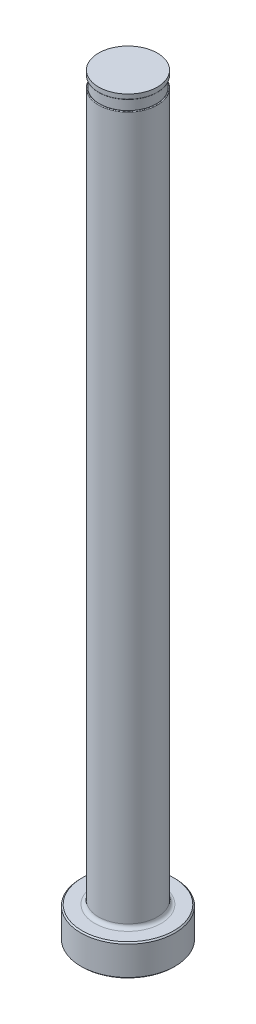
SolidWorks part; units mm, degrees
ref_plane "Front Plane" through (0, 0, 0) normal (0, 0, 1) x (1, 0, 0)
ref_plane "Top Plane" through (0, 0, 0) normal (0, 1, 0) x (1, 0, 0)
ref_plane "Right Plane" through (0, 0, 0) normal (1, 0, 0) x (0, 0, -1)
other "Configuration Table"
sketch "Sketch1" plane through (0, 0, 0) normal (0, 0, 1) x (1, 0, 0)
  line L0 (0, 259.9588) -> (0, -15.1925) construction
  line L1 (0, 0) -> (-9.525, 0)
  line L2 (-9.525, 0) -> (-9.525, 6.35)
  line L3 (-9.525, 6.35) -> (-5.9525, 6.35)
  line L4 (-5.9525, 6.35) -> (-5.9525, 152.4)
  line L5 (-5.9525, 152.4) -> (0, 152.4)
  line L6 (0, 152.4) -> (0, 0)
  dimension "L" = 152.4
  dimension "H" = 19.05
  dimension "T" = 6.35
  dimension "D" = 11.905
revolve "Revolve1" add sketch "Sketch1" angle 360 about L0
chamfer "Chamfer1" distance 0.254 angle 45 2 edges at (0, 6.35, 9.525) (0, 0, 9.525)
fillet "Fillet1" radius 0.762 1 edges at (0, 6.35, 5.9525)
sketch "Sketch2" plane through (0, 0, 0) normal (0, 0, 1) x (1, 0, 0)
  line L0 (-5.9525, 152.4) -> (-5.9525, 7.112) construction
  line L1 (-5.9525, 151.384) -> (-5.7493, 151.384)
  line L2 (-5.9525, 151.384) -> (-5.9525, 149.352)
  line L3 (-5.9525, 149.352) -> (-5.7493, 149.352)
  line L4 (-5.7493, 151.384) -> (-5.7493, 149.352)
  line L5 (5.9525, 152.4) -> (-5.9525, 152.4) construction
  line L6 (0, 153.4483) -> (0, 147.3282) construction
  dimension "D1" = 2.032
  dimension "N" = 1.016
  dimension "FD" = 0.2032
  dimension "D3" = 11.4986
revolve "Vent Relief" cut sketch "Sketch2" angle 360 about L6
sketch "Sketch3" plane through (0, 0, 0) normal (0, 0, 1) x (1, 0, 0)
  line L0 (-5.7493, 150.368) -> (-5.7493, 86.868)
  line L1 (-5.7493, 151.384) -> (-5.7493, 149.352) construction
  line L2 (-5.9525, 149.352) -> (-5.9525, 7.112) construction
  line L3 (-5.9525, 85.7504) -> (-5.9525, 150.368)
  line L4 (-5.9525, 150.368) -> (-5.7493, 150.368)
  arc A0 (-5.7493, 86.868) -> (-5.9525, 85.7504) centre (-8.9243, 86.868) cw
  dimension "D1" = 3.175
  dimension "D2" = 63.5
extrude "D-Slot" cut sketch "Sketch3" against normal through all both and the other way through all
sketch "Sketch5" plane through (0, 0, 0) normal (0, 0, 1) x (1, 0, 0)
  line L0 (-5.9525, 151.384) -> (5.9525, 151.384) construction
  line L1 (-5.9525, 152.4) -> (-5.9474, 152.4)
  line L2 (-5.9525, 152.4) -> (-5.9525, 151.384)
  line L3 (-5.9525, 151.384) -> (-5.9474, 151.384)
  line L4 (-5.9474, 152.4) -> (-5.9474, 151.384)
  line L5 (0, 152.6877) -> (0, 150.5771) construction
  dimension "VP" = 0.0051
revolve "Vent Diameter" cut sketch "Sketch5" angle 360 about L5
fillet "Fillet2" radius 0.127 2 edges at (5.9525, 149.352, 0) (0, 151.384, 5.9474)
sketch "Pocket Sketch" plane through (0, 0, 0) normal (0, 0, 1) x (1, 0, 0)
  line L0 (-9.9219, 0) -> (-9.9219, 6.3754)
  line L1 (-9.9219, 6.3754) -> (-6.9129, 6.3754)
  line L2 (-6.1509, 7.1374) -> (-6.1509, 22.225)
  line L3 (-6.1509, 22.225) -> (0, 22.225)
  line L4 (0, 22.225) -> (0, 0)
  line L5 (0, 0) -> (-9.9219, 0)
  line L6 (0, 12.6104) -> (0, -2.4989) construction
  line L7 (-9.525, 6.096) -> (-9.525, 0.254) construction
  line L8 (9.271, 6.35) -> (-9.271, 6.35) construction
  line L9 (-5.9525, 85.7504) -> (-5.9525, 7.112) construction
  line L10 (-6.9129, 6.3754) -> (-6.1509, 7.1374)
  point P3 (-6.1509, 6.3754)
  dimension "D1" = 19.8437
  dimension "D2" = 0.3969
  dimension "D3" = 0.0254
  dimension "D4" = 0.1984
  dimension "D5" = 12.3019
  dimension "D6" = 22.225
